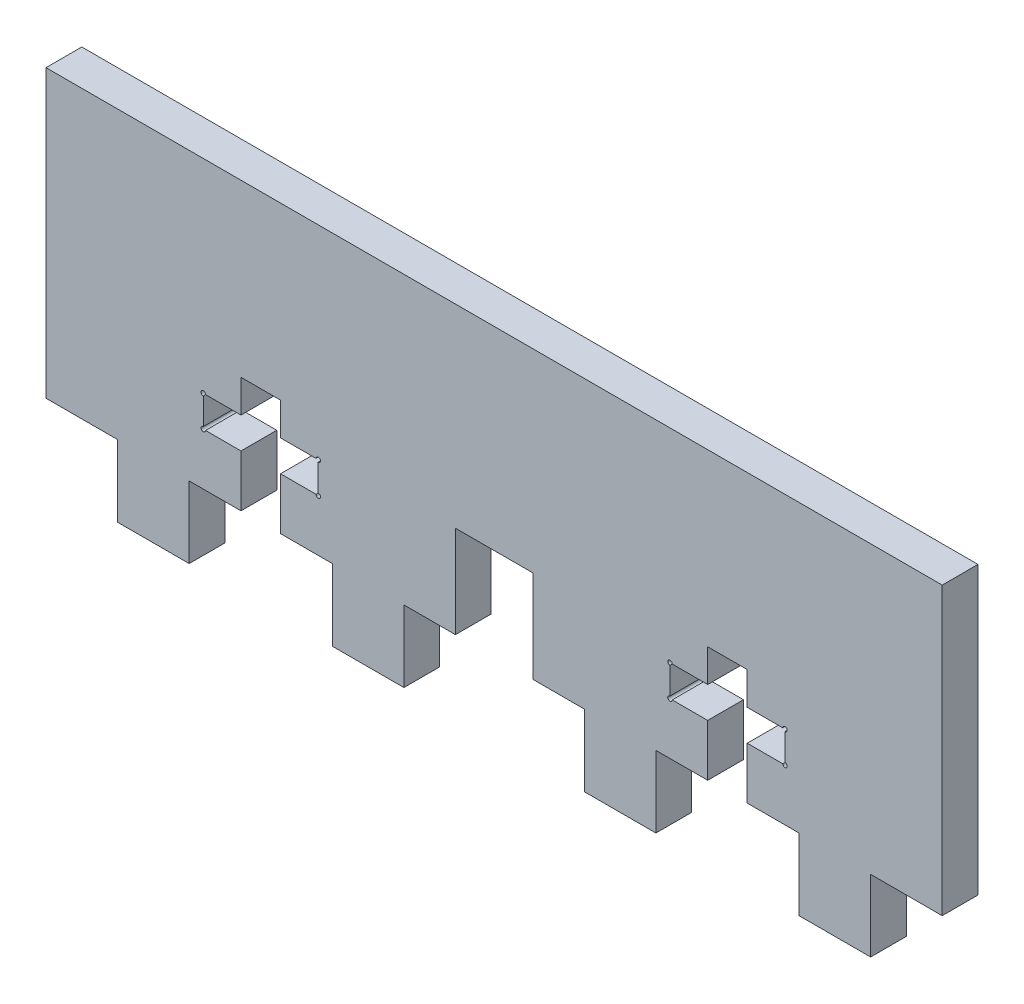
SolidWorks part; units mm, degrees
ref_plane "Front Plane" through (0, 0, 0) normal (0, 0, 1) x (1, 0, 0)
ref_plane "Top Plane" through (0, 0, 0) normal (0, 1, 0) x (1, 0, 0)
ref_plane "Right Plane" through (0, 0, 0) normal (1, 0, 0) x (0, 0, -1)
sketch "Sketch1" plane through (0, 0, 0) normal (0, 0, 1) x (1, 0, 0)
  line L1 (-48.5273, 17.0557) -> (30.9747, 17.0557)
  line L2 (-48.5273, 17.0557) -> (-48.5273, -8.3443)
  line L3 (-48.5273, -8.3443) -> (30.9747, -8.3443)
  line L4 (30.9747, 17.0557) -> (30.9747, -8.3443)
  dimension "D1" = 79.502
  dimension "D2" = 25.4
extrude "Boss-Extrude1" add sketch "Sketch1" along normal blind 3.175
sketch "Sketch2" plane through (0, 0, 0) normal (0, 0, 1) x (1, 0, 0)
  line L0 (-42.1773, -8.3443) -> (-42.1773, -14.6943)
  line L1 (-48.5273, -8.3443) -> (30.9747, -8.3443) construction
  line L2 (-42.1773, -14.6943) -> (-35.8273, -14.6943)
  line L3 (-35.8273, -14.6943) -> (-35.8273, -8.3443)
  line L4 (-23.1273, -8.3443) -> (-23.1273, -14.6943)
  line L5 (-23.1273, -14.6943) -> (-16.7773, -14.6943)
  line L6 (-16.7773, -14.6943) -> (-16.7773, -8.3443)
  line L7 (-0.7753, -8.3443) -> (-0.7753, -14.6943)
  line L8 (-0.7753, -14.6943) -> (5.5747, -14.6943)
  line L9 (5.5747, -14.6943) -> (5.5747, -8.3443)
  line L10 (18.2747, -8.3443) -> (18.2747, -14.6943)
  line L11 (18.2747, -14.6943) -> (24.6247, -14.6943)
  line L12 (24.6247, -14.6943) -> (24.6247, -8.3443)
  line L13 (-42.1773, -8.3443) -> (-35.8273, -8.3443)
  line L14 (-23.1273, -8.3443) -> (-16.7773, -8.3443)
  line L15 (-0.7753, -8.3443) -> (5.5747, -8.3443)
  line L16 (18.2747, -8.3443) -> (24.6247, -8.3443)
  dimension "D1" = 6.35
  dimension "D2" = 6.35
  dimension "D3" = 6.35
  dimension "D4" = 6.35
  dimension "D5" = 6.35
  dimension "D6" = 6.35
  dimension "D7" = 6.35
  dimension "D8" = 12.7
  dimension "D9" = 12.7
extrude "Boss-Extrude2" add sketch "Sketch2" along normal blind 3.175
sketch "Sketch3" plane through (0, 0, 0) normal (0, 0, 1) x (1, 0, 0)
  line L0 (10.1721, -8.3443) -> (10.1721, -3.7418)
  line L1 (-35.8273, -8.3443) -> (-23.1273, -8.3443) construction
  line L4 (-31.2299, -8.3443) -> (-31.2299, -3.7418)
  line L5 (-31.2299, -3.7418) -> (-34.5768, -3.7418)
  line L6 (-34.5768, -3.7418) -> (-34.5768, -0.9859)
  line L7 (-34.5768, -0.9859) -> (-31.2299, -0.9859)
  line L8 (-31.2299, -0.9859) -> (-31.2299, 1.9148)
  line L9 (-31.2299, 1.9148) -> (-27.7247, 1.9148)
  line L10 (-27.7247, 1.9148) -> (-27.7247, -0.9859)
  line L11 (-27.7247, -0.9859) -> (-24.3777, -0.9859)
  line L12 (-24.3777, -0.9859) -> (-24.3777, -3.7418)
  line L13 (-24.3777, -3.7418) -> (-27.7247, -3.7418)
  line L14 (-27.7247, -3.7418) -> (-27.7247, -8.3443)
  line L15 (-31.2299, -8.3443) -> (-27.7247, -8.3443)
  line L16 (10.1721, -0.9859) -> (10.1721, 1.9148)
  line L17 (10.1721, 1.9148) -> (13.6773, 1.9148)
  line L18 (17.0243, -0.9859) -> (17.0243, -3.7418)
  line L19 (13.6773, -3.7418) -> (13.6773, -8.3443)
  line L20 (6.8252, -3.7418) -> (6.8252, -0.9859)
  line L21 (10.1721, -8.3443) -> (13.6773, -8.3443)
  line L22 (10.1721, -3.7418) -> (6.8252, -3.7418)
  line L23 (13.6773, -0.9859) -> (17.0243, -0.9859)
  line L24 (13.6773, 1.9148) -> (13.6773, -0.9859)
  line L25 (17.0243, -3.7418) -> (13.6773, -3.7418)
  line L26 (6.8252, -0.9859) -> (10.1721, -0.9859)
  line L27 (-16.7773, -8.3443) -> (-0.7753, -8.3443) construction
  line L29 (-12.2053, -8.3443) -> (-5.3473, -8.3443)
  line L30 (-12.2053, -8.3443) -> (-12.2053, -0.1655)
  line L31 (-12.2053, -0.1655) -> (-5.3473, -0.1655)
  line L32 (-5.3473, -8.3443) -> (-5.3473, -0.1655)
  dimension "D1" = 3.5052
  dimension "D2" = 3.5052
  dimension "D3" = 4.6025
  dimension "D4" = 2.7559
  dimension "D5" = 2.9007
  dimension "D6" = 4.6025
  dimension "D7" = 2.7559
  dimension "D8" = 2.9007
  dimension "D9" = 6.858
  dimension "D10" = 8.1788
extrude "Cut-Extrude1" cut sketch "Sketch3" along normal blind 9.017
sketch "Sketch4" plane through (0, 0, 0) normal (0, 0, 1) x (1, 0, 0)
  circle A0 centre (-34.5768, -0.9859) radius 0.1981
  circle A1 centre (-34.5768, -3.7418) radius 0.1981
  circle A2 centre (-24.3777, -0.9859) radius 0.1981
  circle A3 centre (-24.3777, -3.7418) radius 0.1981
  circle A4 centre (6.8252, -0.9859) radius 0.1981
  circle A5 centre (6.8252, -3.7418) radius 0.1981
  circle A6 centre (17.0243, -0.9859) radius 0.1981
  circle A7 centre (17.0243, -3.7418) radius 0.1981
  dimension "D1" = 0.3962
extrude "Cut-Extrude2" cut sketch "Sketch4" along normal blind 6.604
scale "Scale1" bodies to scale 104 scale about centroid uniform scaling yes scale factor 0.5
